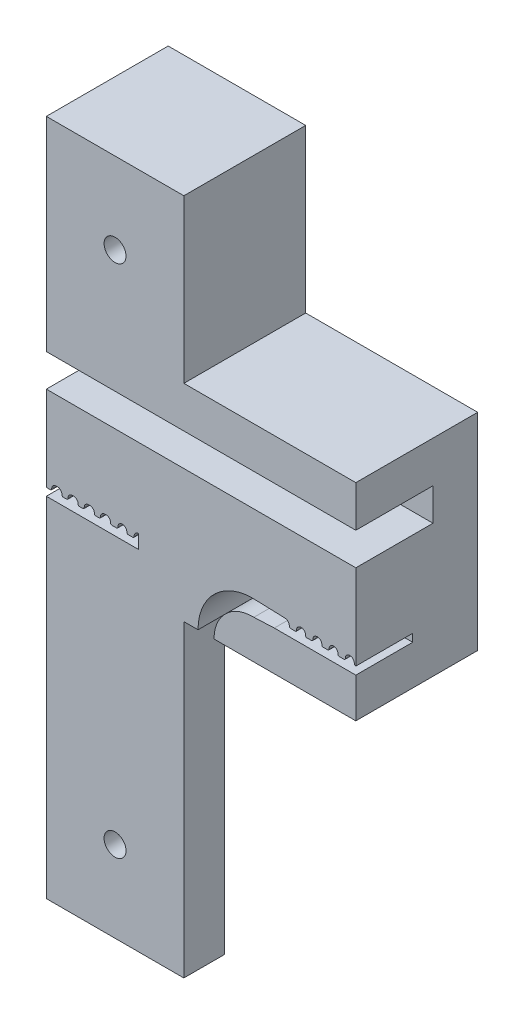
SolidWorks part; units mm, degrees
ref_plane "Front Plane" through (0, 0, 0) normal (0, 0, 1) x (1, 0, 0)
ref_plane "Top Plane" through (0, 0, 0) normal (0, 1, 0) x (1, 0, 0)
ref_plane "Right Plane" through (0, 0, 0) normal (1, 0, 0) x (0, 0, -1)
sketch "Sketch1" plane through (0, 0, 0) normal (0, 0, 1) x (1, 0, 0)
  line L1 (-25.4, -12.7) -> (25.4, -12.7)
  line L2 (-25.4, -12.7) -> (-25.4, 12.7)
  line L3 (-25.4, 12.7) -> (25.4, 12.7)
  line L4 (25.4, -12.7) -> (25.4, 12.7)
  line L5 (-25.4, -12.7) -> (25.4, 12.7) construction
  line L6 (-25.4, 12.7) -> (25.4, -12.7) construction
  point P0 (0, 0)
  dimension "D1" = 50.8
  dimension "D2" = 25.4
extrude "Boss-Extrude1" add sketch "Sketch1" along normal blind 12.46
sketch "Sketch3" plane through (0, 0, 12.46) normal (0, 0, 1) x (1, 0, 0)
  line L18 (-23.4652, -6.1) -> (-23.4591, -6.1)
  line L19 (-21.4652, -6.1) -> (-21.4591, -6.1)
  line L20 (-19.4654, -6.1) -> (-19.4591, -6.1)
  line L21 (-17.4652, -6.1) -> (-17.4591, -6.1)
  line L27 (18.6591, -6.1) -> (18.6652, -6.1)
  line L28 (20.6591, -6.1) -> (20.6652, -6.1)
  line L29 (22.6591, -6.1) -> (22.6652, -6.1)
  line L30 (24.6591, -6.1) -> (24.6652, -6.1)
  line L32 (16.6798, -6.1004) -> (13.256, -5.9831)
  line L33 (25.365, -6.86) -> (25.365, -7.82)
  line L34 (-25.4393, -7.8004) -> (-15.4652, -7.8004)
  line L35 (15.365, -7.82) -> (25.365, -7.82)
  line L38 (15.365, -7.82) -> (12.8505, -7.931)
  line L47 (5.9752, -12.7) -> (7.943, -12.7)
  line L48 (19.365, -6.86) -> (19.9562, -6.86)
  line L49 (21.365, -6.86) -> (21.9562, -6.86)
  line L50 (23.365, -6.86) -> (23.9562, -6.86)
  line L51 (-25.4393, -6.1004) -> (-25.4393, -7.8004)
  line L52 (-15.4652, -6.1004) -> (-15.4652, -7.8004)
  line L390 (17.215, -6.6226) -> (17.2131, -6.6226)
  line L391 (17.215, -6.71) -> (17.215, -6.6226)
  line L392 (17.9562, -6.86) -> (17.365, -6.86)
  line L398 (19.215, -6.6226) -> (19.2131, -6.6226)
  line L399 (19.215, -6.71) -> (19.215, -6.6226)
  line L406 (21.215, -6.6226) -> (21.2131, -6.6226)
  line L407 (21.215, -6.71) -> (21.215, -6.6226)
  line L414 (23.215, -6.6226) -> (23.2131, -6.6226)
  line L415 (23.215, -6.71) -> (23.215, -6.6226)
  line L422 (25.215, -6.6226) -> (25.2131, -6.6226)
  line L423 (25.215, -6.71) -> (25.215, -6.6226)
  line L1628 (8.8889, -27.3539) -> (8.8889, 27.3539) construction
  line L1737 (-24.9041, -6.6549) -> (-24.9041, -6.6559)
  line L1738 (-24.7562, -6.86) -> (-24.165, -6.86)
  line L1739 (-24.015, -6.71) -> (-24.015, -6.6226)
  line L1740 (-24.015, -6.6226) -> (-24.0131, -6.6226)
  line L1745 (-22.9041, -6.6549) -> (-22.9041, -6.6559)
  line L1746 (-22.7562, -6.86) -> (-22.165, -6.86)
  line L1747 (-22.015, -6.71) -> (-22.015, -6.6226)
  line L1748 (-22.015, -6.6226) -> (-22.0131, -6.6226)
  line L1753 (-20.9041, -6.6549) -> (-20.9041, -6.6559)
  line L1754 (-20.7562, -6.86) -> (-20.165, -6.86)
  line L1755 (-20.015, -6.71) -> (-20.015, -6.6226)
  line L1756 (-20.015, -6.6226) -> (-20.0131, -6.6226)
  line L1761 (-18.9041, -6.655) -> (-18.9041, -6.656)
  line L1762 (-18.7563, -6.86) -> (-18.1651, -6.8601)
  line L1763 (-18.0151, -6.7101) -> (-18.0151, -6.6226)
  line L1764 (-18.0151, -6.6226) -> (-18.0132, -6.6226)
  line L1770 (-16.7562, -6.86) -> (-16.165, -6.86)
  line L1771 (-16.015, -6.71) -> (-16.015, -6.6226)
  line L1772 (-16.015, -6.6226) -> (-16.0131, -6.6226)
  line L1773 (-15.4652, -6.1) -> (-15.4652, -6.1004)
  arc A3 (13.256, -5.9831) -> (5.9752, -12.7) centre (12.714, -12.7) ccw
  arc A5 (12.8505, -7.931) -> (7.943, -12.7) centre (12.714, -12.7) ccw
  arc A235 (17.2131, -6.6226) -> (16.6798, -6.1004) centre (16.6591, -6.655) ccw
  arc A236 (17.215, -6.71) -> (17.365, -6.86) centre (17.365, -6.71) ccw
  arc A237 (17.9562, -6.86) -> (18.1057, -6.6983) centre (17.9562, -6.71) ccw
  arc A238 (18.1041, -6.6549) -> (18.1057, -6.6983) centre (18.6591, -6.655) ccw
  arc A239 (18.6591, -6.1) -> (18.1041, -6.6549) centre (18.6591, -6.655) ccw
  arc A240 (19.2131, -6.6226) -> (18.6652, -6.1) centre (18.6591, -6.655) ccw
  arc A241 (19.215, -6.71) -> (19.365, -6.86) centre (19.365, -6.71) ccw
  arc A242 (19.9562, -6.86) -> (20.1058, -6.6983) centre (19.9562, -6.71) ccw
  arc A243 (20.1041, -6.6549) -> (20.1058, -6.6983) centre (20.6591, -6.655) ccw
  arc A244 (20.6591, -6.1) -> (20.1041, -6.6549) centre (20.6591, -6.655) ccw
  arc A245 (21.2131, -6.6226) -> (20.6652, -6.1) centre (20.6591, -6.655) ccw
  arc A246 (21.215, -6.71) -> (21.365, -6.86) centre (21.365, -6.71) ccw
  arc A247 (21.9562, -6.86) -> (22.1057, -6.6983) centre (21.9562, -6.71) ccw
  arc A248 (22.1041, -6.655) -> (22.1057, -6.6983) centre (22.6591, -6.655) ccw
  arc A249 (22.6591, -6.1) -> (22.1041, -6.655) centre (22.6591, -6.655) ccw
  arc A250 (23.2131, -6.6226) -> (22.6652, -6.1) centre (22.6591, -6.655) ccw
  arc A251 (23.215, -6.71) -> (23.365, -6.86) centre (23.365, -6.71) ccw
  arc A252 (23.9562, -6.86) -> (24.1058, -6.6983) centre (23.9562, -6.71) ccw
  arc A253 (24.1041, -6.655) -> (24.1058, -6.6983) centre (24.6591, -6.655) ccw
  arc A254 (24.6591, -6.1) -> (24.1041, -6.655) centre (24.6591, -6.655) ccw
  arc A255 (25.2131, -6.6226) -> (24.6652, -6.1) centre (24.6591, -6.655) ccw
  arc A256 (25.215, -6.71) -> (25.365, -6.86) centre (25.365, -6.71) ccw
  arc A1065 (-25.4393, -6.1004) -> (-24.9041, -6.6549) centre (-25.4591, -6.655) cw
  arc A1066 (-24.9041, -6.6559) -> (-24.9057, -6.6983) centre (-25.4591, -6.655) cw
  arc A1067 (-24.7562, -6.86) -> (-24.9057, -6.6983) centre (-24.7562, -6.71) cw
  arc A1068 (-24.015, -6.71) -> (-24.165, -6.86) centre (-24.165, -6.71) cw
  arc A1069 (-24.0131, -6.6226) -> (-23.4652, -6.1) centre (-23.4591, -6.655) cw
  arc A1070 (-23.4591, -6.1) -> (-22.9041, -6.6549) centre (-23.4591, -6.655) cw
  arc A1071 (-22.9041, -6.6559) -> (-22.9058, -6.6983) centre (-23.4591, -6.655) cw
  arc A1072 (-22.7562, -6.86) -> (-22.9058, -6.6983) centre (-22.7562, -6.71) cw
  arc A1073 (-22.015, -6.71) -> (-22.165, -6.86) centre (-22.165, -6.71) cw
  arc A1074 (-22.0131, -6.6226) -> (-21.4652, -6.1) centre (-21.4591, -6.655) cw
  arc A1075 (-21.4591, -6.1) -> (-20.9041, -6.6549) centre (-21.4591, -6.655) cw
  arc A1076 (-20.9041, -6.6559) -> (-20.9057, -6.6983) centre (-21.4591, -6.655) cw
  arc A1077 (-20.7562, -6.86) -> (-20.9057, -6.6983) centre (-20.7562, -6.71) cw
  arc A1078 (-20.015, -6.71) -> (-20.165, -6.86) centre (-20.165, -6.71) cw
  arc A1079 (-20.0131, -6.6226) -> (-19.4654, -6.1) centre (-19.4591, -6.655) cw
  arc A1080 (-19.4591, -6.1) -> (-18.9041, -6.655) centre (-19.4591, -6.655) cw
  arc A1081 (-18.9041, -6.656) -> (-18.9058, -6.6983) centre (-19.4591, -6.655) cw
  arc A1082 (-18.7563, -6.86) -> (-18.9058, -6.6983) centre (-18.7563, -6.71) cw
  arc A1083 (-18.0151, -6.7101) -> (-18.1651, -6.8601) centre (-18.1651, -6.7101) cw
  arc A1084 (-18.0132, -6.6226) -> (-17.4652, -6.1) centre (-17.4591, -6.655) cw
  arc A1085 (-17.4591, -6.1) -> (-16.9041, -6.6549) centre (-17.4591, -6.655) cw
  arc A1086 (-16.9041, -6.6549) -> (-16.9058, -6.6983) centre (-17.4591, -6.655) cw
  arc A1087 (-16.7562, -6.86) -> (-16.9058, -6.6983) centre (-16.7562, -6.71) cw
  arc A1088 (-16.015, -6.71) -> (-16.165, -6.86) centre (-16.165, -6.71) cw
  arc A1089 (-16.0131, -6.6226) -> (-15.4652, -6.1) centre (-15.4591, -6.655) cw
  point P24 (8.8889, 0)
  dimension "D2" = 6.7387
  dimension "D4" = 4.7709
  dimension "D1" = 1.7
  dimension "D5" = 3.4238
  dimension "D6" = 3.9659
sketch "Sketch4" plane through (0, 0, 12.46) normal (0, 0, 1) x (1, 0, 0)
  line L1 (-19.05, -12.7) -> (19.05, -12.7)
  line L2 (-19.05, -12.7) -> (-19.05, 12.7)
  line L3 (-19.05, 12.7) -> (19.05, 12.7)
  line L4 (19.05, -12.7) -> (19.05, 12.7)
  line L5 (-19.05, -12.7) -> (19.05, 12.7) construction
  line L6 (-19.05, 12.7) -> (19.05, -12.7) construction
  point P0 (0, 0)
  dimension "D1" = 38.1
extrude "Boss-Extrude2" add sketch "Sketch4" along normal blind 44.45
sketch "Sketch5" plane through (0, 12.7, 0) normal (0, 1, 0) x (1, 0, 0)
  line L1 (-13.335, -44.845) -> (13.335, -44.845)
  line L2 (-13.335, -44.845) -> (-13.335, -18.175)
  line L3 (-13.335, -18.175) -> (13.335, -18.175)
  line L4 (13.335, -44.845) -> (13.335, -18.175)
  line L5 (-13.335, -44.845) -> (13.335, -18.175) construction
  line L6 (-13.335, -18.175) -> (13.335, -44.845) construction
  line L8 (-19.05, -56.91) -> (-19.05, -12.46) construction
  line L9 (19.05, -56.91) -> (-19.05, -56.91) construction
  point P0 (0, -31.51)
  point P9 (0, -31.51)
  dimension "D1" = 19.05
  dimension "D2" = 26.67
  dimension "D3" = 26.67
  dimension "D4" = 25.4
extrude "Cut-Extrude1" cut sketch "Sketch5" against normal blind 19.05
sketch "Sketch7" plane through (0, -6.35, 0) normal (0, 1, 0) x (1, 0, 0)
  line L0 (-13.335, -44.845) -> (13.335, -44.845) construction
  circle A0 centre (0, -31.51) radius 3.429
  point P0 (0, -31.51)
  dimension "D2" = 6.858
  dimension "D1" = 13.335
extrude "Cut-Extrude2" cut sketch "Sketch7" against normal through all
sketch "Sketch8" plane through (-25.4, 0, 0) normal (-1, 0, 0) x (0, 0, 1)
  line L0 (0, 12.7) -> (0, -12.7) construction
  line L2 (-5.207, 1.3879) -> (-5.207, -1.3879)
  line L5 (0, 2.54) -> (0, -2.54)
  line L7 (-4.3402, 3.2989) -> (-2.667, 4.764)
  line L8 (-2.667, 4.764) -> (-2.667, 2.54)
  line L10 (-2.667, -4.764) -> (-2.667, -2.54)
  line L11 (-4.3402, -3.2989) -> (-2.667, -4.764)
  line L12 (-2.667, 2.54) -> (0, 2.54)
  line L13 (-2.667, -2.54) -> (0, -2.54)
  arc A0 (-4.3402, 3.2989) -> (-5.207, 1.3879) centre (-2.667, 1.3879) ccw
  arc A1 (-5.207, -1.3879) -> (-4.3402, -3.2989) centre (-2.667, -1.3879) ccw
  point P0 (-3.937, -1.0959)
  dimension "D1" = 2.54
  dimension "D2" = 2.54
  dimension "D7" = 2.224
  dimension "D3" = 5.08
  dimension "D4" = 9.5279
  dimension "D5" = 2.54
  dimension "D6" = 2.224
  dimension "D8" = 2.667
  dimension "D9" = 2.54
sketch "Sketch10" plane through (25.4, 0, 0) normal (1, 0, 0) x (0, 0, -1)
  line L0 (-12.46, -12.7) -> (-12.46, 12.7) construction
  line L2 (-12.46, 7.62) -> (-12.46, 3.62)
  line L7 (-12.46, 7.62) -> (-4.96, 7.62)
  line L8 (-4.96, 7.62) -> (-4.96, 3.62)
  line L9 (-4.96, 3.62) -> (-12.46, 3.62)
  dimension "D1" = 7.5
  dimension "D2" = 4
extrude "Cut-Extrude3" cut sketch "Sketch10" against normal through all
extrude "Cut-Extrude4" cut sketch "Sketch3" against normal blind 7
sketch "Sketch11" plane through (0, 0, 0) normal (0, 0, -1) x (-1, 0, 0)
  line L1 (-25.4, 12.7) -> (25.4, 12.7)
  line L2 (-25.4, 12.7) -> (-25.4, -12.7)
  line L3 (-25.4, -12.7) -> (25.4, -12.7)
  line L4 (25.4, 12.7) -> (25.4, -12.7)
extrude "Boss-Extrude3" add sketch "Sketch11" along normal blind 2.54
sketch "Sketch12" plane through (0, 0, 56.91) normal (0, 0, 1) x (1, 0, 0)
  circle A0 centre (0, 0) radius 2.54
  dimension "D1" = 5.08
extrude "Cut-Extrude5" cut sketch "Sketch12" against normal blind 7.62
sketch "Sketch13" plane through (-19.05, 0, 0) normal (-1, 0, 0) x (0, 0, 1)
  line L1 (12.46, 12.7) -> (56.91, 12.7)
  line L2 (12.46, 12.7) -> (12.46, -12.7)
  line L3 (12.46, -12.7) -> (56.91, -12.7)
  line L4 (56.91, 12.7) -> (56.91, -12.7)
extrude "Cut-Extrude6" cut sketch "Sketch13" against normal through all
sketch "Sketch15" plane through (25.365, 0, 0) normal (-1, 0, 0) x (0, 0, 1)
  line L0 (5.46, -6.86) -> (5.46, -7.82)
  line L1 (5.46, -7.82) -> (5.46, -6.86) construction
  line L2 (5.46, -7.82) -> (12.46, -7.82)
  line L3 (12.46, -7.82) -> (12.46, -6.86)
  line L4 (12.46, -6.86) -> (5.46, -6.86)
extrude "Cut-Extrude8" cut sketch "Sketch15" against normal blind 10
sketch "Sketch16" plane through (0, 12.7, 0) normal (0, 1, 0) x (1, 0, 0)
  line L6 (-25.4, -12.46) -> (4.23, -12.46)
  line L7 (-25.4, -12.46) -> (-25.4, 2.54)
  line L8 (-25.4, 2.54) -> (4.23, 2.54)
  line L9 (4.23, -12.46) -> (4.23, 2.54)
  dimension "D1" = 15
  dimension "D2" = 29.63
extrude "Boss-Extrude4" add sketch "Sketch16" along normal blind 20
sketch "Sketch17" plane through (0, -12.7, 0) normal (0, -1, 0) x (1, 0, 0)
  line L0 (5.9752, 5.46) -> (5.9752, 12.46) construction
  line L9 (-25.4, 12.46) -> (4.2252, 12.46)
  line L10 (-25.4, 12.46) -> (-25.4, 7.46)
  line L11 (-25.4, 7.46) -> (4.2252, 7.46)
  line L12 (4.2252, 12.46) -> (4.2252, 7.46)
  dimension "D1" = 5
  dimension "D2" = 1.75
extrude "Boss-Extrude5" add sketch "Sketch17" along normal blind 38
sketch "Sketch18" plane through (0, 0, 12.46) normal (0, 0, 1) x (1, 0, 0)
ref_plane "Plane2" through (-15.47, 0, 0) normal (-1, 0, 0) x (0, 0, 1)
mirror "Mirror1" about plane through (-15.47, 0, 0) normal (-1, 0, 0) of "Cut-Extrude4"
ref_plane "Plane3" through (-13.4, 0, 0) normal (-1, 0, 0) x (0, 0, 1)
mirror "Mirror2" about plane through (-13.4, 0, 0) normal (-1, 0, 0) of "Cut-Extrude4"
sketch "Sketch27" plane through (0, 0, 12.46) normal (0, 0, 1) x (1, 0, 0)
  line L0 (4.2252, -50.7) -> (-25.4, -50.7) construction
  line L1 (-25.4, 32.7) -> (-12.7, 32.7)
  line L2 (-25.4, 32.7) -> (-25.4, -50.7)
  line L3 (-25.4, -50.7) -> (-12.7, -50.7)
  line L4 (-12.7, 32.7) -> (-12.7, -50.7)
  dimension "D1" = 12.7
extrude "Cut-Extrude12" cut sketch "Sketch27" against normal through all
ref_plane "Plane4" through (-12.7, -6.8601, 12.46) normal (0, 1, 0) x (1, 0, 0)
sketch "Sketch31" plane through (0, 0, 12.46) normal (0, 0, 1) x (1, 0, 0)
  line L0 (-12.7, 32.7) -> (4.23, 32.7) construction
  line L1 (-12.7, 7.62) -> (-12.7, 32.7) construction
  line L2 (4.2252, -50.7) -> (-12.7, -50.7) construction
  circle A3 centre (-4.24, 22.7) radius 1.35
  circle A4 centre (-4.24, -40.7) radius 1.35
  dimension "D1" = 2.7
  dimension "D2" = 10
  dimension "D4" = 2.7
  dimension "D5" = 10
  dimension "D3" = 8.46
extrude "Cut-Extrude13" cut sketch "Sketch31" against normal through all
sketch "Sketch32" plane through (25.4, 0, 0) normal (1, 0, 0) x (0, 0, -1)
  line L1 (-12.46, 32.7) -> (2.54, 32.7)
  line L2 (-12.46, 32.7) -> (-12.46, -12.7)
  line L3 (-12.46, -12.7) -> (2.54, -12.7)
  line L4 (2.54, 32.7) -> (2.54, -12.7)
sketch "Sketch36" plane through (25.4, 0, 0) normal (1, 0, 0) x (0, 0, -1)
  line L0 (-12.46, 3.62) -> (-4.96, 3.62) construction
  line L1 (-4.96, 7.62) -> (-2.96, 7.62)
  line L2 (-4.96, 7.62) -> (-4.96, 3.62)
  line L3 (-4.96, 3.62) -> (-2.96, 3.62)
  line L4 (-2.96, 7.62) -> (-2.96, 3.62)
  dimension "D1" = 0
  dimension "D2" = 2
extrude "Cut-Extrude16" cut sketch "Sketch36" against normal through all
